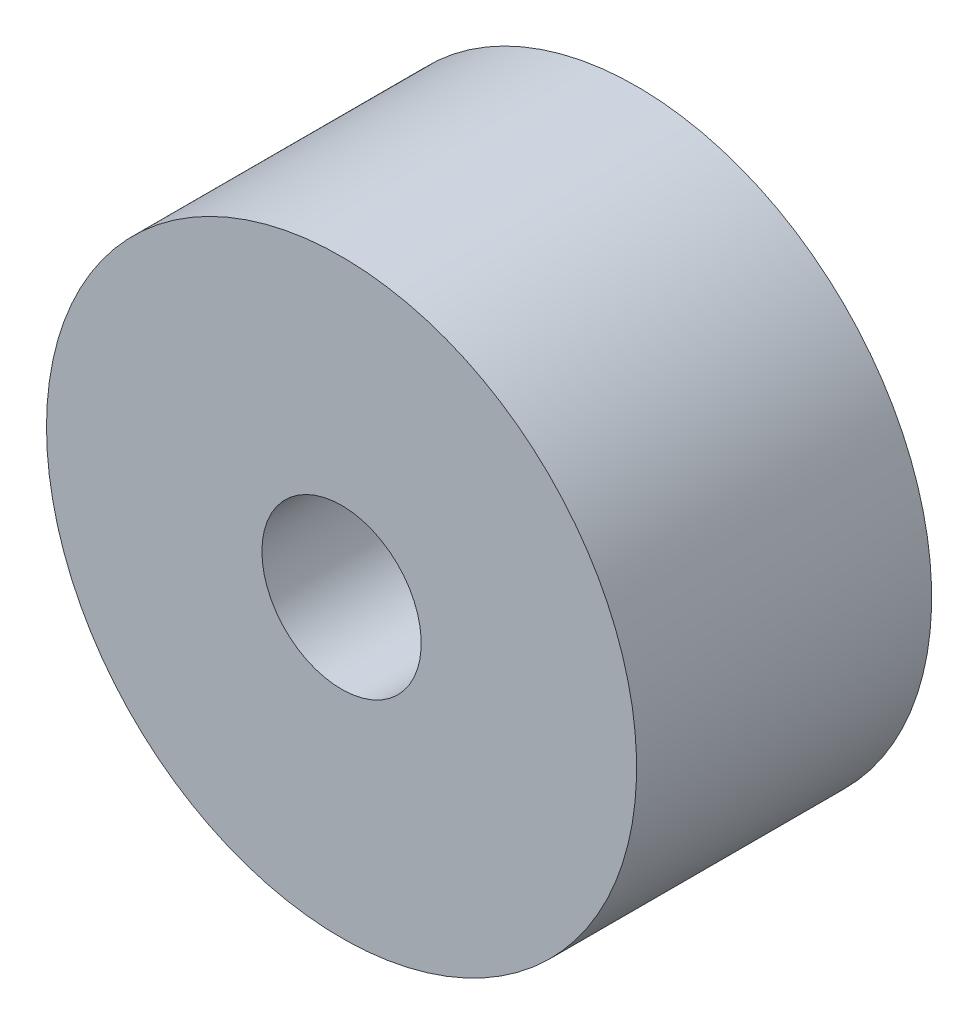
SolidWorks part; units mm, degrees
ref_plane "Front Plane" through (0, 0, 0) normal (0, 0, 1) x (1, 0, 0)
ref_plane "Top Plane" through (0, 0, 0) normal (0, 1, 0) x (1, 0, 0)
ref_plane "Right Plane" through (0, 0, 0) normal (1, 0, 0) x (0, 0, -1)
sketch "Sketch1" plane through (0, 0, -11.4802) normal (0, 0, -1) x (-1, 0, 0)
  circle A0 centre (-12.4931, 19.5198) radius 1.35
  circle A1 centre (-12.4931, 19.5198) radius 5
  dimension "D1" = 2.7
  dimension "D2" = 10
extrude "Boss-Extrude1" add sketch "Sketch1" against normal blind 5
